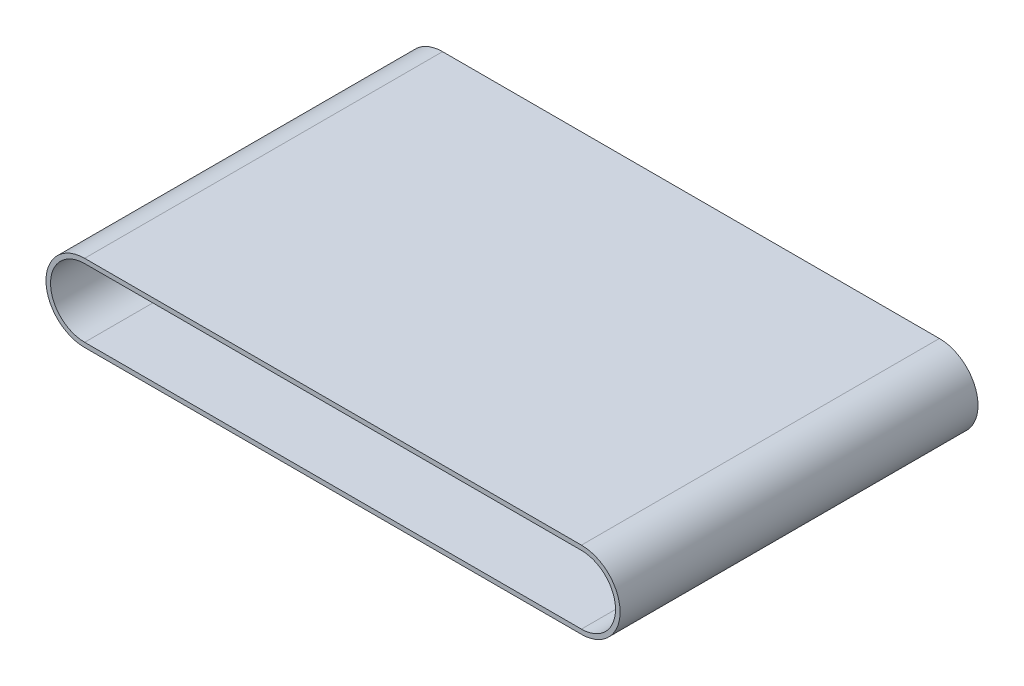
SolidWorks part; units mm, degrees
ref_plane "Front Plane" through (0, 0, 0) normal (0, 0, 1) x (1, 0, 0)
ref_plane "Top Plane" through (0, 0, 0) normal (0, 1, 0) x (1, 0, 0)
ref_plane "Right Plane" through (0, 0, 0) normal (1, 0, 0) x (0, 0, -1)
sketch "Sketch2" plane through (0, 0, 0) normal (0, 0, 1) x (1, 0, 0)
  line L0 (0, 0) -> (1, 0) construction
  line L1 (0, 0) -> (0, 1) construction
  line L2 (0, -19.05) -> (-277.5914, -19.05)
  line L3 (-277.5914, 19.05) -> (0, 19.05)
  arc A0 (0, 19.05) -> (0, -19.05) centre (0, 0) cw
  arc A1 (-277.5914, -19.05) -> (-277.5914, 19.05) centre (-277.5914, 0) cw
sketch "Sketch3" plane through (0, 0, 1285) normal (0, 0, -1) x (-1, 0, 0)
  line L0 (0, -19.05) -> (277.5914, -19.05) construction
  line L1 (277.5914, 19.05) -> (0, 19.05) construction
  line L2 (0, -19.05) -> (277.5914, -19.05)
  line L3 (277.5914, 19.05) -> (0, 19.05)
  line L4 (277.5914, 21.59) -> (0, 21.59)
  line L5 (0, -21.59) -> (277.5914, -21.59)
  arc A0 (277.5914, -19.05) -> (277.5914, 19.05) centre (277.5914, 0) ccw construction
  arc A1 (0, 19.05) -> (0, -19.05) centre (0, 0) ccw construction
  arc A2 (277.5914, -19.05) -> (277.5914, 19.05) centre (277.5914, 0) ccw
  arc A3 (0, 19.05) -> (0, -19.05) centre (0, 0) ccw
  arc A4 (277.5914, -21.59) -> (277.5914, 21.59) centre (277.5914, 0) ccw
  arc A5 (0, 21.59) -> (0, -21.59) centre (0, 0) ccw
  dimension "D1" = 2.54
extrude "Boss-Extrude1" add sketch "Sketch3" along normal up to surface (200 mm away)
